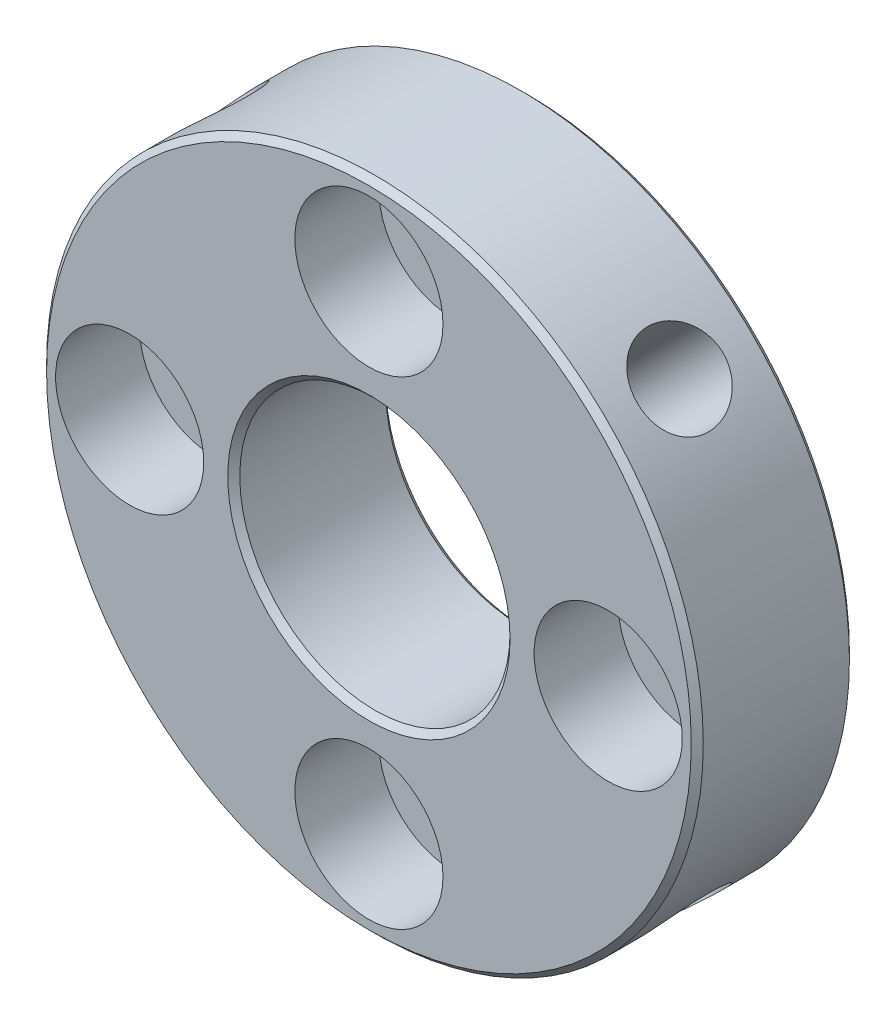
SolidWorks part; units mm, degrees
ref_plane "Piano frontale" through (0, 0, 0) normal (0, 0, 1) x (1, 0, 0)
ref_plane "Piano superiore" through (0, 0, 0) normal (0, 1, 0) x (1, 0, 0)
ref_plane "Piano destro" through (0, 0, 0) normal (1, 0, 0) x (0, 0, -1)
sketch "Schizzo1" plane through (0, 0, 0) normal (0, 0, 1) x (1, 0, 0)
  circle A0 centre (0, 0) radius 16.4
  dimension "D1" = 32.8
extrude "Estrusione1" add sketch "Schizzo1" against normal blind 7.9
sketch "Schizzo2" plane through (0, 0, 0) normal (0, 0, 1) x (1, 0, 0)
  circle A0 centre (0, 0) radius 6.75
  dimension "D1" = 13.5
extrude "Taglio-Estrusione1" cut sketch "Schizzo2" against normal up to next
chamfer "Smusso1" distance 0.3 angle 45 4 edges at (6.75, 0, -7.9) (16.4, 0, -7.9) (16.4, 0, 0) (6.75, 0, 0)
sketch "Schizzo5" plane through (0, 0, 0) normal (0, 0, 1) x (1, 0, 0)
  line L0 (0, -4.345) -> (0, 4.345) construction
  circle A0 centre (0, 11.95) radius 3.7
  dimension "D1" = 7.4
  dimension "D2" = 11.95
extrude "Taglio-Estrusione2" cut sketch "Schizzo5" against normal blind 4.2
sketch "Schizzo7" plane through (0, 0, -4.2) normal (0, 0, 1) x (1, 0, 0)
  line L0 (0, -4.345) -> (0, 4.345) construction
  circle A0 centre (0, 11.95) radius 2.15
  circle A1 centre (0, 11.95) radius 3.7 construction
  dimension "D1" = 4.3
extrude "Taglio-Estrusione3" cut sketch "Schizzo7" against normal up to next
pattern_circular "RipetizioneCircolare1" count 4 over 360 about axis through (0, 0, 0) along (0, 0, 1) of "Taglio-Estrusione2", "Taglio-Estrusione3"
ref_plane "Piano1" through (0, 0, 0) normal (0.7071, 0.7071, 0) x (-0.7071, 0.7071, 0)
ref_plane "Piano2" through (0, 0, 0) normal (-0.7071, 0.7071, 0) x (0, 0, 1)
ref_plane "Piano3" through (-11.5966, 11.5966, 0) normal (-0.7071, 0.7071, 0) x (0, 0, 1)
sketch "Schizzo12" plane through (-11.5966, 11.5966, 0) normal (-0.7071, 0.7071, 0) x (0, 0, 1)
  line L0 (9.087, 0) -> (-9.087, 0) construction
  line L1 (0, -16.1) -> (0, 16.1) construction
  circle A0 centre (-3.95, 0) radius 2.15
  dimension "D2" = 4.3
  dimension "D1" = 3.95
extrude "Taglio-Estrusione4" cut sketch "Schizzo12" against normal blind 8.6
pattern_circular "RipetizioneCircolare2" count 4 over 360 about axis through (0, 0, 0) along (0, 0, 1) of "Taglio-Estrusione4"
